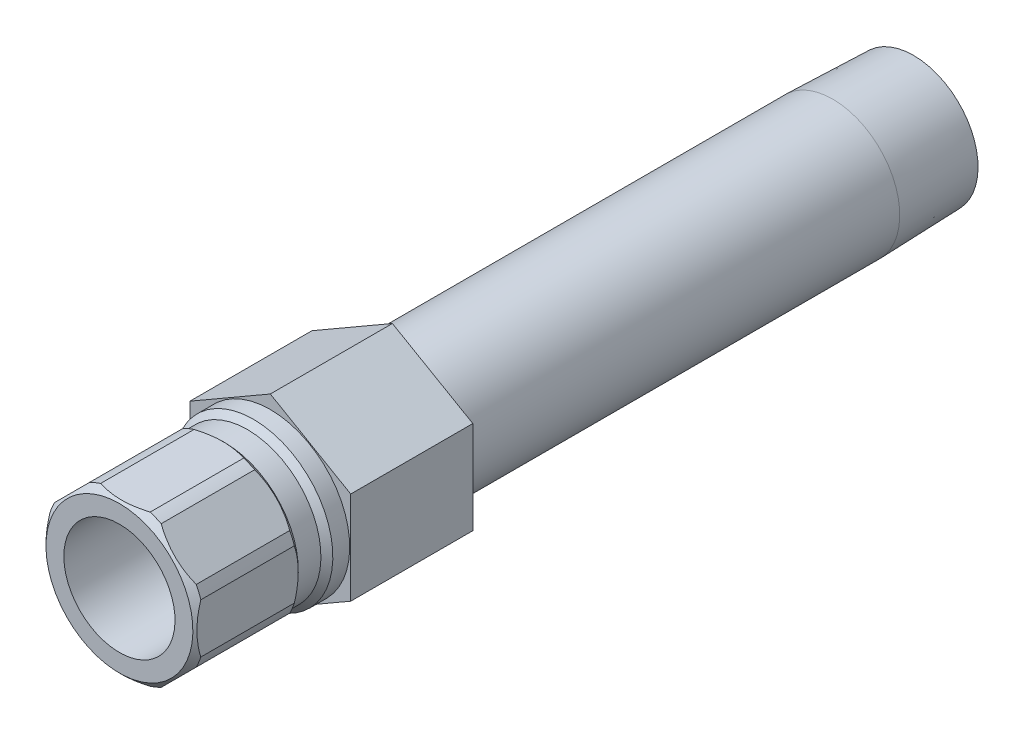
SolidWorks part; units mm, degrees
ref_plane "Front Plane" through (0, 0, 0) normal (0, 0, 1) x (1, 0, 0)
ref_plane "Top Plane" through (0, 0, 0) normal (0, 1, 0) x (1, 0, 0)
ref_plane "Right Plane" through (0, 0, 0) normal (1, 0, 0) x (0, 0, -1)
sketch "Sketch1" plane through (0, 0, 0) normal (1, 0, 0) x (0, 0, -1)
  line L0 (0, 0) -> (-22.479, 0) construction
  line L1 (-19.304, 7.112) -> (-19.304, 9.398)
  line L2 (-5.8166, 9.398) -> (-5.8166, 0) construction
  line L3 (-18.542, 10.16) -> (-6.5786, 10.16)
  line L4 (0, 8.5725) -> (0, 0) construction
  line L5 (-5.8166, 9.398) -> (-2.921, 9.398)
  line L6 (-2.159, 10.16) -> (0, 10.16)
  line L7 (0, 10.16) -> (0, 8.5725)
  line L8 (-5.8166, 9.398) -> (-6.5786, 10.16)
  line L9 (-2.921, 9.398) -> (-2.159, 10.16)
  line L10 (-19.304, 9.398) -> (-18.542, 10.16)
  line L11 (-19.304, 7.112) -> (-1.524, 7.112)
  line L12 (0, 8.5725) -> (71.9582, 8.5725)
  line L13 (71.9582, 8.5725) -> (82.296, 8.2494)
  line L14 (82.296, 8.2494) -> (82.296, 6.2611)
  line L15 (0, 10.16) -> (15.621, 10.16) construction
  line L16 (15.621, 10.16) -> (15.621, 7.112) construction
  line L17 (9.271, 0) -> (0, 0) construction
  line L18 (-1.524, 7.112) -> (-0.6731, 6.2611)
  line L19 (-0.6731, 6.2611) -> (82.296, 6.2611)
  dimension "D1" = 19.304
  dimension "D2" = 2.8956
  dimension "D3" = 0.762
  dimension "D4" = 45
  dimension "D5" = 13.4874
  dimension "D6" = 45
  dimension "D7" = 1.79
  dimension "D8" = 10.3378
  dimension "D9" = 101.6
  dimension "D10" = 3.175
  dimension "D11" = 34.925
  dimension "D12" = 14.224
  dimension "D13" = 17.145
  dimension "D14" = 20.32
  dimension "D15" = 12.5222
  dimension "D16" = 17.78
revolve "Revolve1" add sketch "Sketch1" angle 360 about L0
sketch "Sketch2" plane through (0, 0, 0) normal (0, 0, 1) x (1, 0, 0)
  line L1 (-10.287, 5.9392) -> (-10.287, -5.9392)
  line L2 (-10.287, -5.9392) -> (0, -11.8784)
  line L3 (0, -11.8784) -> (10.287, -5.9392)
  line L4 (10.287, -5.9392) -> (10.287, 5.9392)
  line L5 (10.287, 5.9392) -> (0, 11.8784)
  line L6 (0, 11.8784) -> (-10.287, 5.9392)
  circle A0 centre (0, 0) radius 10.287 construction
  circle A1 centre (0, 0) radius 6.2611 construction
  circle A2 centre (0, 0) radius 6.2611
  dimension "D1" = 20.574
extrude "Boss-Extrude1" add sketch "Sketch2" against normal up to vertex (15.621 mm away) from vertex at 0
sketch "Sketch3" plane through (0, 0, 0) normal (0, 0, 1) x (1, 0, 0)
  line L1 (9.652, -3.998) -> (9.652, 3.998)
  line L2 (9.652, 3.998) -> (3.998, 9.652)
  line L3 (3.998, 9.652) -> (-3.998, 9.652)
  line L4 (-3.998, 9.652) -> (-9.652, 3.998)
  line L5 (-9.652, 3.998) -> (-9.652, -3.998)
  line L6 (-9.652, -3.998) -> (-3.998, -9.652)
  line L7 (-3.998, -9.652) -> (3.998, -9.652)
  line L8 (3.998, -9.652) -> (9.652, -3.998)
  circle A0 centre (0, 0) radius 9.652 construction
  dimension "D1" = 19.304
extrude "Cut-Extrude1" cut sketch "Sketch3" along normal through all from vertex at 5.8166 flip side to cut
